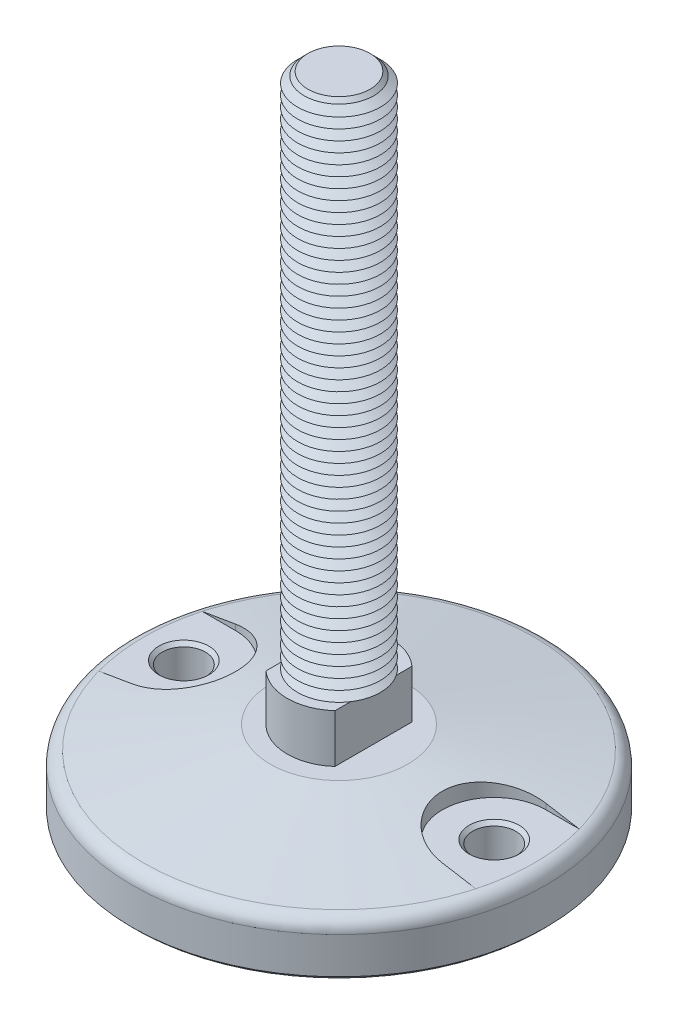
SolidWorks part; units mm, degrees
ref_plane "Front Plane" through (0, 0, 0) normal (0, 0, 1) x (1, 0, 0)
ref_plane "Top Plane" through (0, 0, 0) normal (0, 1, 0) x (1, 0, 0)
ref_plane "Right Plane" through (0, 0, 0) normal (1, 0, 0) x (0, 0, -1)
sketch "Sketch1" plane through (0, 0, 0) normal (1, 0, 0) x (0, 0, -1)
  line L0 (0, 61.3389) -> (0, -58.404) construction
sketch "Sketch2" plane through (0, 0, 0) normal (1, 0, 0) x (0, 0, -1)
  line L0 (0, 0) -> (-20, 0)
  line L1 (-20, 0) -> (-60, -7.0531)
  line L2 (-60, -7.0531) -> (-60, -22)
  line L3 (-60, -22) -> (0, -22)
  line L4 (0, 61.3389) -> (0, -58.404) construction
  line L5 (0, -22) -> (0, 0)
  dimension "D1" = 22
  dimension "D2" = 60
  dimension "D3" = 20
  dimension "D4" = 10
revolve "Revolve1" add sketch "Sketch2" angle 360 about L0
fillet "Fillet1" radius 4 1 edges at (0, -7.0531, 60)
sketch "Sketch3" plane through (0, 0, 0) normal (0, 1, 0) x (1, 0, 0)
  circle A0 centre (0, 0) radius 15
  dimension "D1" = 30
extrude "Boss-Extrude1" add sketch "Sketch3" along normal blind 14
sketch "Sketch4" plane through (0, 14, 0) normal (0, 1, 0) x (1, 0, 0)
  line L0 (-10, 11.1803) -> (-10, -11.1803)
  line L2 (10, -11.1803) -> (10, 11.1803)
  arc A0 (-10, 11.1803) -> (-10, -11.1803) centre (0, 0) ccw
  circle A1 centre (0, 0) radius 15 construction
  arc A2 (10, -11.1803) -> (10, 11.1803) centre (0, 0) ccw
  dimension "D1" = 20
extrude "Cut-Extrude1" cut sketch "Sketch4" against normal blind 14
sketch "Sketch5" plane through (0, 14, 0) normal (0, 1, 0) x (1, 0, 0)
  circle A0 centre (0, 0) radius 12
  dimension "D1" = 24
extrude "Boss-Extrude2" add sketch "Sketch5" along normal blind 150
chamfer "Chamfer1" distance 3 angle 45 1 edges at (0, 164, 12)
sketch "Sketch6" plane through (0, 0, 0) normal (1, 0, 0) x (0, 0, -1)
  line L0 (-12, 14) -> (-9.4019, 15.5)
  line L1 (-9.4019, 15.5) -> (-12, 17)
  line L2 (-12, 161) -> (-12, 14) construction
  line L3 (-12, 17) -> (-12, 14)
  dimension "D1" = 3
revolve "Cut-Revolve1" cut sketch "Sketch6" angle 360 about L0
pattern_linear "LPattern1" count 50 spacing 3 along (0, 1, 0) of "Cut-Revolve1"
sketch "Sketch8" plane through (0, 0, 0) normal (0, 1, 0) x (1, 0, 0)
  line L0 (-45, 15) -> (-54.6743, 15)
  line L1 (-45, -15) -> (-54.6743, -15)
  arc A1 (-54.6743, 15) -> (-54.6743, -15) centre (0, 0) ccw
  circle A2 centre (0, 0) radius 56.6946 construction
  arc A3 (-45, -15) -> (-45, 15) centre (-45, 0) ccw
  point P3 (-45, 0)
  point P11 (0, 0)
  dimension "D1" = 45
  dimension "D2" = 30
extrude "Cut-Extrude4" cut sketch "Sketch8" against normal blind 6.47
sketch "Sketch10" plane through (0, -6.47, 0) normal (0, 1, 0) x (1, 0, 0)
  circle A0 centre (-45, 0) radius 6.25
  dimension "D1" = 12.5
extrude "Cut-Extrude5" cut sketch "Sketch10" against normal up to surface (15.53 mm away)
chamfer "Chamfer2" distance 1 angle 45 2 edges at (-45, -22, -6.25) (-45, -6.47, 6.25)
mirror "Mirror1" about plane through (0, 0, 0) normal (1, 0, 0) of "Chamfer2", "Cut-Extrude5", "Cut-Extrude4"
chamfer "Chamfer3" distance 1 angle 45 1 edges at (0, -22, 60)
